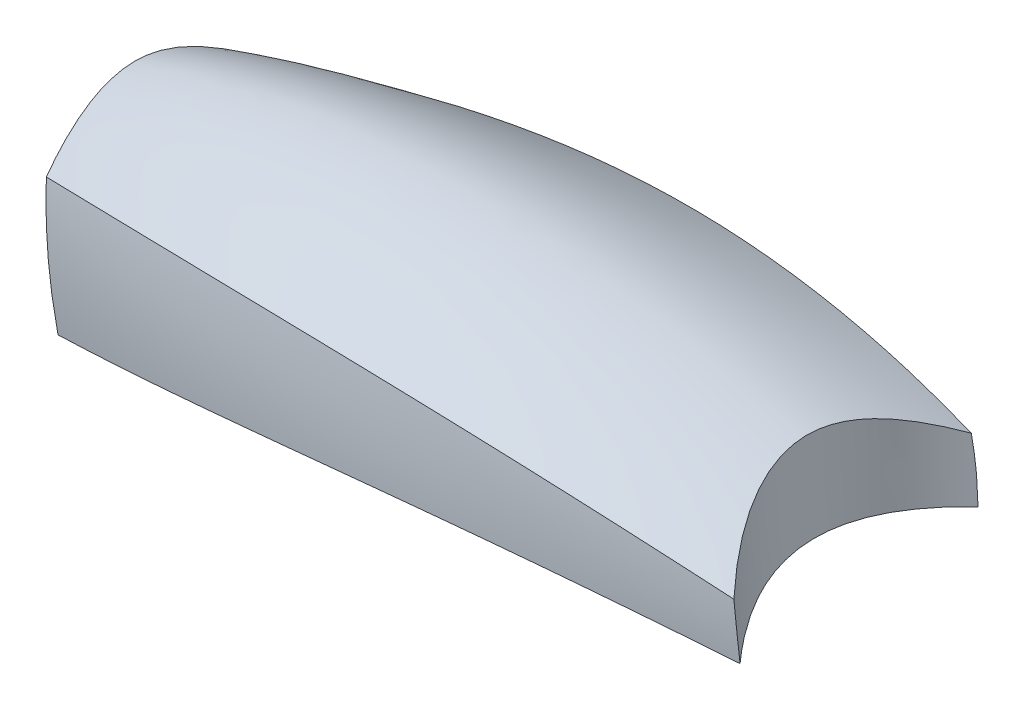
SolidWorks part; units mm, degrees
ref_plane "Front Plane" through (0, 0, 0) normal (0, 0, 1) x (1, 0, 0)
ref_plane "Top Plane" through (0, 0, 0) normal (0, 1, 0) x (1, 0, 0)
ref_plane "Right Plane" through (0, 0, 0) normal (1, 0, 0) x (0, 0, -1)
imported_body "Surface-Imported1"
imported_body "Surface-Imported2"
imported_body "Surface-Imported3"
imported_body "Surface-Imported4"
imported_body "Surface-Imported5"
imported_body "Surface-Imported6"
other "Intersect1"
